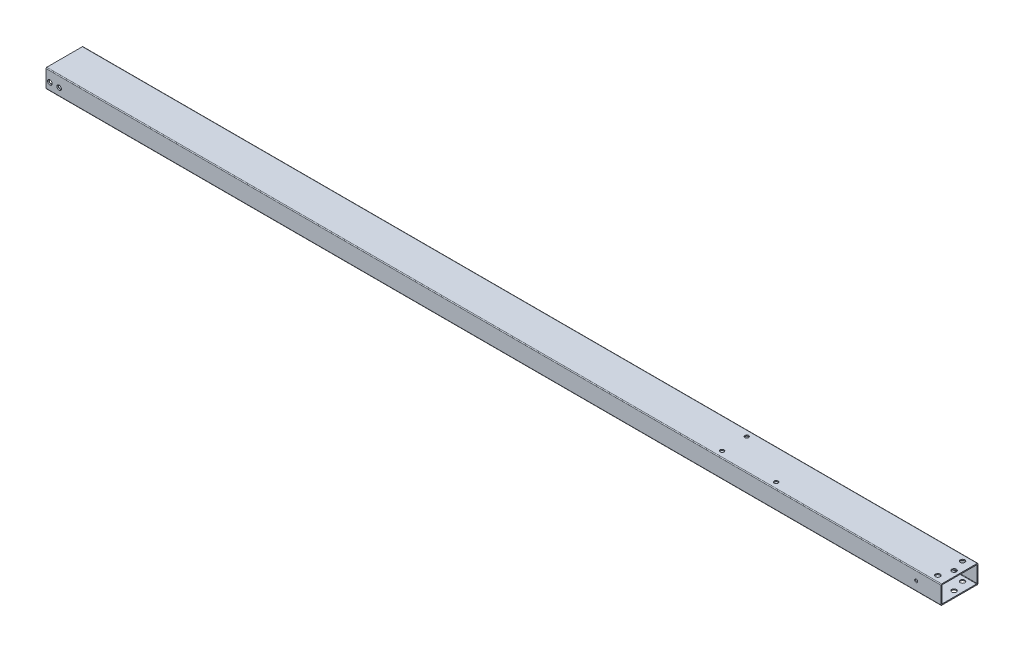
SolidWorks part; units mm, degrees
ref_plane "Front Plane" through (0, 0, 0) normal (0, 0, 1) x (1, 0, 0)
ref_plane "Top Plane" through (0, 0, 0) normal (0, 1, 0) x (1, 0, 0)
ref_plane "Right Plane" through (0, 0, 0) normal (1, 0, 0) x (0, 0, -1)
sketch "Sketch1" plane through (0, 0, 0) normal (1, 0, 0) x (0, 0, -1)
  line L1 (38.1, 19.05) -> (-38.1, 19.05)
  line L2 (38.1, 19.05) -> (38.1, -19.05)
  line L3 (38.1, -19.05) -> (-38.1, -19.05)
  line L4 (-38.1, 19.05) -> (-38.1, -19.05)
  line L5 (38.1, 19.05) -> (-38.1, -19.05) construction
  line L6 (38.1, -19.05) -> (-38.1, 19.05) construction
  point P0 (0, 0)
  dimension "D1" = 76.2
  dimension "D2" = 38.1
extrude "Extrude-Thin1" add sketch "Sketch1" along normal blind 1838.325 thin
fillet "Fillet1" radius 0.7874 4 edges at (919.1625, -16.9418, 35.9918) (919.1625, -16.9418, -35.9918) (919.1625, 16.9418, -35.9918) (919.1625, 16.9418, 35.9918)
fillet "Fillet2" radius 1.5748 4 edges at (919.1625, 19.05, 38.1) (919.1625, -19.05, 38.1) (919.1625, -19.05, -38.1) (919.1625, 19.05, -38.1)
sketch "Sk-Top" plane through (0, 0, 0) normal (0, 1, 0) x (1, 0, 0)
  line L0 (0, 0) -> (328.9301, 0) construction
  line L1 (1838.325, 36.5252) -> (1838.325, -36.5252) construction
  circle A0 centre (1819.275, -25.4) radius 4.7625
  circle A1 centre (1819.275, 25.4) radius 4.7625
  circle A2 centre (1827.1998, 0) radius 4.7625
  circle A3 centre (1487.17, -25.4) radius 3.9624
  circle A4 centre (1376.045, 25.4) radius 3.9624
  circle A5 centre (1376.045, -25.4) radius 3.9624
  dimension "D2" = 9.525
  dimension "D4" = 9.525
  dimension "D6" = 7.9248
  dimension "D1" = 50.8
  dimension "D3" = 19.05
  dimension "D5" = 7.9248
  dimension "D7" = 351.155
  dimension "D8" = 111.125
  dimension "D9" = 50.8
sketch "Sketch3" plane through (0, 0, 0) normal (0, 1, 0) x (1, 0, 0)
  circle A0 centre (1819.275, -25.4) radius 4.7625 construction
  circle A1 centre (1819.275, 25.4) radius 4.7625 construction
  circle A2 centre (1819.275, -25.4) radius 4.7625
  circle A3 centre (1819.275, 25.4) radius 4.7625
  circle A4 centre (1827.1998, 0) radius 4.7625 construction
  circle A5 centre (1827.1998, 0) radius 4.7625
  circle A6 centre (1376.045, 25.4) radius 3.9624 construction
  circle A7 centre (1487.17, -25.4) radius 3.9624 construction
  circle A8 centre (1376.045, -25.4) radius 3.9624 construction
  circle A9 centre (1376.045, 25.4) radius 3.9624
  circle A10 centre (1487.17, -25.4) radius 3.9624
  circle A11 centre (1376.045, -25.4) radius 3.9624
extrude "Cut-Extrude1" cut sketch "Sketch3" against normal mid plane 50.8
sketch "Sketch4" plane through (0, 0, 0) normal (0, 0, 1) x (1, 0, 0)
  circle A0 centre (7.9248, -3.175) radius 3.175
  circle A1 centre (26.9748, -3.175) radius 3.175
  dimension "D1" = 6.35
  dimension "D2" = 3.175
  dimension "D3" = 7.9248
  dimension "D4" = 19.05
extrude "Cut-Extrude2" cut sketch "Sketch4" against normal mid plane 101.6
chamfer "Chamfer1" distance 1.524 angle 45 4 edges at (7.9248, -6.35, -38.1) (26.9748, -6.35, -38.1) (26.9748, 0, 38.1) (7.9248, 0, 38.1)
sketch "Sketch5" plane through (0, 0, 0) normal (0, 1, 0) x (1, 0, 0)
  line L0 (0, 0) -> (45.8256, 0) construction
  circle A0 centre (17.4498, 14.2875) radius 4.7625
  circle A1 centre (17.4498, -14.2875) radius 4.7625
  dimension "D1" = 9.525
  dimension "D2" = 17.4498
  dimension "D3" = 28.575
extrude "Cut-Extrude3" cut sketch "Sketch5" against normal blind 58.42
sketch "Sketch6" plane through (0, 0, 0) normal (0, 0, 1) x (1, 0, 0)
  line L0 (1838.325, 17.4752) -> (1838.325, -17.4752) construction
  line L1 (1838.325, -19.05) -> (0, -19.05) construction
  circle A0 centre (1787.525, 0) radius 3.175
  dimension "D2" = 6.35
  dimension "D1" = 50.8
  dimension "D3" = 19.05
extrude "Cut-Extrude4" cut sketch "Sketch6" against normal mid plane 101.6
